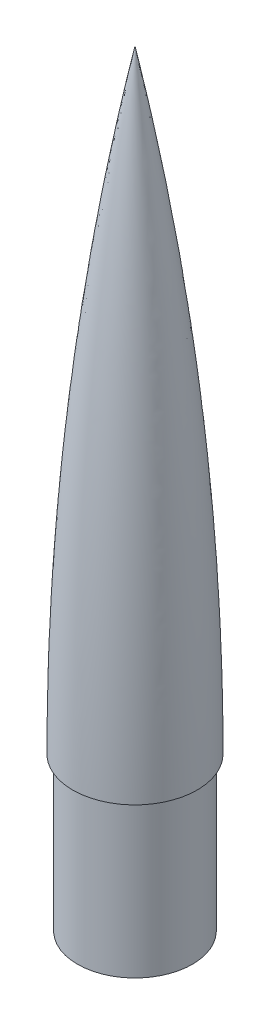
SolidWorks part; units mm, degrees
ref_plane "Front Plane" through (0, 0, 0) normal (0, 0, 1) x (1, 0, 0)
ref_plane "Top Plane" through (0, 0, 0) normal (0, 1, 0) x (1, 0, 0)
ref_plane "Right Plane" through (0, 0, 0) normal (1, 0, 0) x (0, 0, -1)
sketch "Sketch1" plane through (0, 0, 0) normal (0, 0, 1) x (1, 0, 0)
  line L0 (0, 0) -> (-19.05, 0)
  line L1 (-19.05, 0) -> (-19.05, 50.8)
  line L2 (-19.05, 50.8) -> (-20.6375, 50.8)
  line L3 (0, 254) -> (0, 0) construction
  line L4 (0, 0) -> (0, 254)
  arc A0 (-20.6375, 50.8) -> (0, 254) centre (990.0505, 50.8) cw
  dimension "D1" = 19.05
  dimension "D2" = 50.8
  dimension "D3" = 1.5875
  dimension "D4" = 254
revolve "Revolve1" add sketch "Sketch1" angle 360 about L3
shell "Shell3" thickness 1.5875
